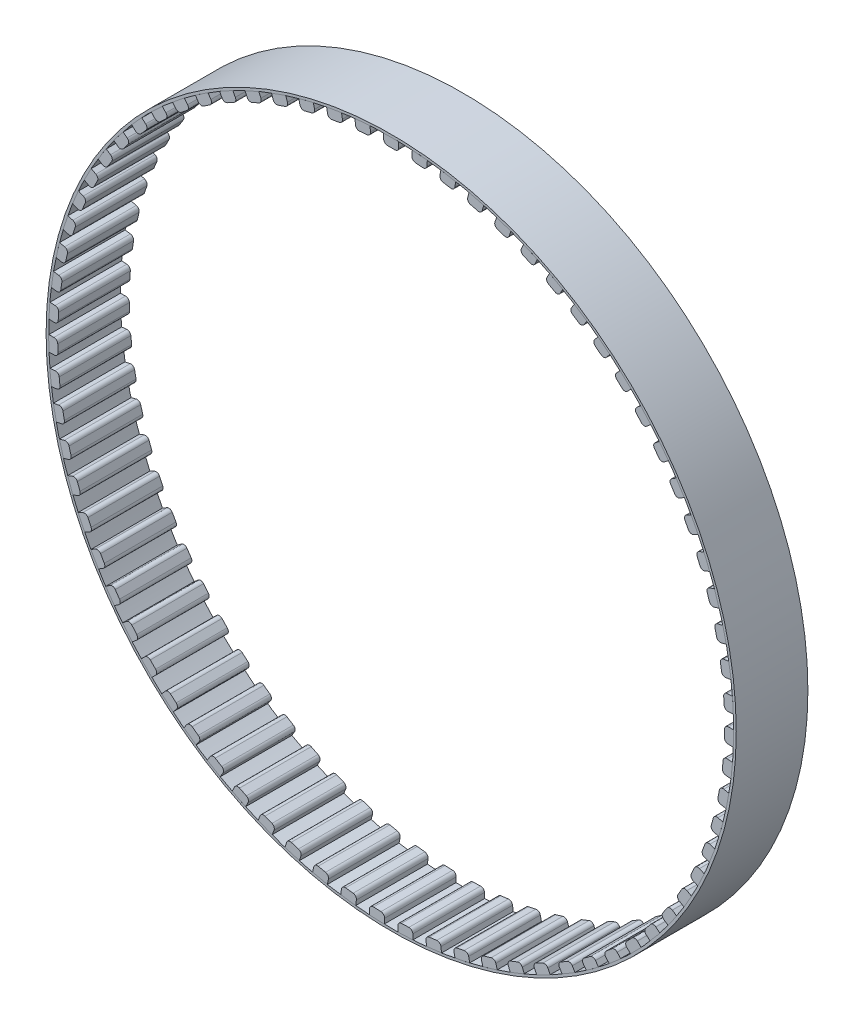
SolidWorks part; units mm, degrees
ref_plane "Plan de face" through (0, 0, 0) normal (0, 0, 1) x (1, 0, 0)
ref_plane "Plan de dessus" through (0, 0, 0) normal (0, 1, 0) x (1, 0, 0)
ref_plane "Plan de droite" through (0, 0, 0) normal (1, 0, 0) x (0, 0, -1)
sketch "Esquisse1" plane through (0, 0, 0) normal (0, 0, 1) x (1, 0, 0)
  circle A0 centre (0, 0) radius 45.75
  dimension "D1" = 91.5
extrude "Boss.-Extru.1" add sketch "Esquisse1" along normal blind 9.5
sketch "Esquisse2" plane through (0, 0, 9.5) normal (0, 0, 1) x (1, 0, 0)
  circle A0 centre (0, 0) radius 45.4126
  dimension "D1" = 90.8251
extrude "Enlèv. mat.-Extru.1" cut sketch "Esquisse2" against normal blind 9.5
sketch "Esquisse3" plane through (0, 0, 0) normal (0, 0, -1) x (-1, 0, 0)
  line L0 (-1, 44.2015) -> (1, 44.2015)
  line L2 (1, 44.2015) -> (1, 45.4015)
  line L3 (1, 45.4015) -> (-1, 45.4015)
  line L4 (-1, 45.4015) -> (-1, 44.2015)
  circle A0 centre (0, 0) radius 45.4126 construction
  dimension "D1" = 2
  dimension "D2" = 1.2
extrude "Boss.-Extru.2" add sketch "Esquisse3" against normal blind 9.5 separate body
fillet "Congé2" radius 0.5 2 edges at (-1, 44.2015, 4.75) (1, 44.2015, 4.75)
pattern_circular "Répétition circulaire7" count 75 over 360 about axis through (0, 0, 0) along (0, 0, 1)
